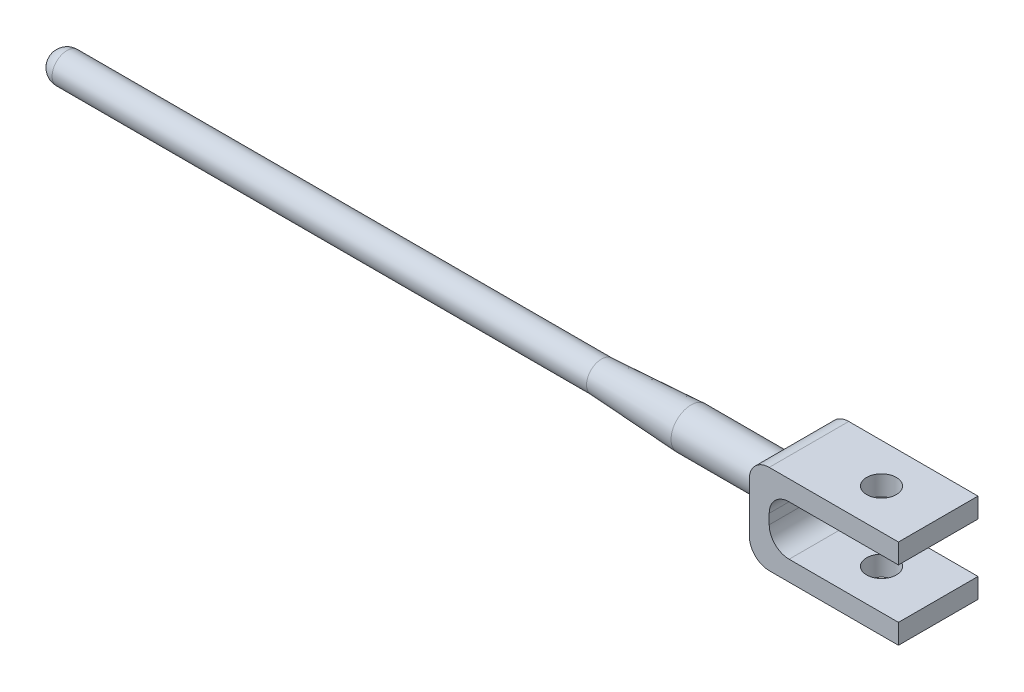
SolidWorks part; units mm, degrees
ref_plane "Plan de face" through (0, 0, 0) normal (0, 0, 1) x (1, 0, 0)
ref_plane "Plan de dessus" through (0, 0, 0) normal (0, 1, 0) x (1, 0, 0)
ref_plane "Plan de droite" through (0, 0, 0) normal (1, 0, 0) x (0, 0, -1)
sketch "Esquisse1" plane through (0, 0, 0) normal (0, 0, 1) x (1, 0, 0)
  line L0 (-10.86, 4.5) -> (-23.86, 4.5)
  line L1 (-25.86, 2.5) -> (-25.86, -2.5)
  line L2 (-23.86, -4.5) -> (-10.86, -4.5)
  line L3 (-10.86, -4.5) -> (-10.86, -2.5)
  line L4 (-10.86, -2.5) -> (-21.86, -2.5)
  line L5 (-23.86, -0.5) -> (-23.86, 0.5)
  line L6 (-21.86, 2.5) -> (-10.86, 2.5)
  line L7 (-10.86, 2.5) -> (-10.86, 4.5)
  arc A0 (-25.86, 2.5) -> (-23.86, 4.5) centre (-23.86, 2.5) cw
  arc A1 (-23.86, -4.5) -> (-25.86, -2.5) centre (-23.86, -2.5) cw
  arc A2 (-21.86, -2.5) -> (-23.86, -0.5) centre (-21.86, -0.5) cw
  arc A3 (-23.86, 0.5) -> (-21.86, 2.5) centre (-21.86, 0.5) cw
  point P12 (-25.86, -4.5)
  point P15 (-23.86, -2.5)
  point P18 (-23.86, 2.5)
  dimension "D6" = 2
  dimension "D1" = 5
  dimension "D2" = 2
  dimension "D3" = 2
  dimension "D4" = 15
  dimension "D5" = 13
  dimension "D7" = 4.5
extrude "Extrusion1" add sketch "Esquisse1" along normal blind 8
sketch "Esquisse2" plane through (0, 4.5, 0) normal (0, 1, 0) x (1, 0, 0)
  circle A0 centre (-16.5926, -3.9745) radius 1.5
  dimension "D1" = 3
extrude "Enlèv. mat.-Extru.1" cut sketch "Esquisse2" against normal through all
sketch "Esquisse4" plane through (0, 0, 0) normal (0, 1, 0) x (1, 0, 0)
  line L0 (-25.86, -2) -> (-35.7326, -2)
  line L1 (-25.86, -8) -> (-25.86, 0) construction
  line L2 (-35.7326, -2) -> (-44.7326, -2.4995)
  line L3 (-44.7326, -2.4995) -> (-98.49, -2.4995)
  line L4 (-99.99, -3.9995) -> (-25.86, -3.9995)
  line L5 (-10.86, 0) -> (-23.86, 0) construction
  line L6 (-25.86, -8) -> (-23.86, -8) construction
  line L7 (-25.86, -2) -> (-25.86, -3.9995)
  arc A0 (-98.49, -2.4995) -> (-99.99, -3.9995) centre (-98.49, -3.9995) ccw
  dimension "D1" = 1.5
  dimension "D2" = 72.63
  dimension "D3" = 9
  dimension "D4" = 2
  dimension "D5" = 4.0005
revolve "Révolution1" add sketch "Esquisse4" angle 360 about L4
sketch "Esquisse5" plane through (0, 0, 0) normal (0, 1, 0) x (1, 0, 0)
  line L0 (-98.49, -5.4995) -> (-98.49, -2.4995) construction
  point P0 (-98.49, -3.9995)
